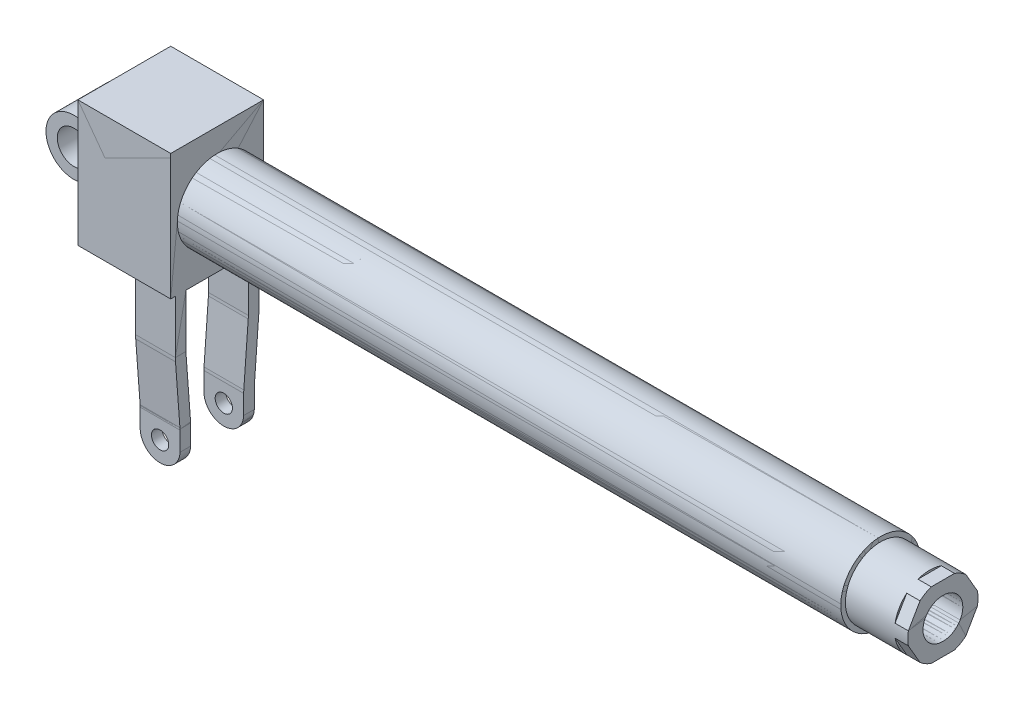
SolidWorks part; units mm, degrees
ref_plane "Plan de face" through (0, 0, 0) normal (0, 0, 1) x (1, 0, 0)
ref_plane "Plan de dessus" through (0, 0, 0) normal (0, 1, 0) x (1, 0, 0)
ref_plane "Plan de droite" through (0, 0, 0) normal (1, 0, 0) x (0, 0, -1)
imported_body "Importée1"
sketch "Esquisse1" plane through (85, 0, 0) normal (1, 0, 0) x (0, 0, -1)
  circle A0 centre (0, 0) radius 20
  dimension "D1" = 40
extrude "Enlèv. mat.-Extru.1" cut sketch "Esquisse1" along normal blind 450
